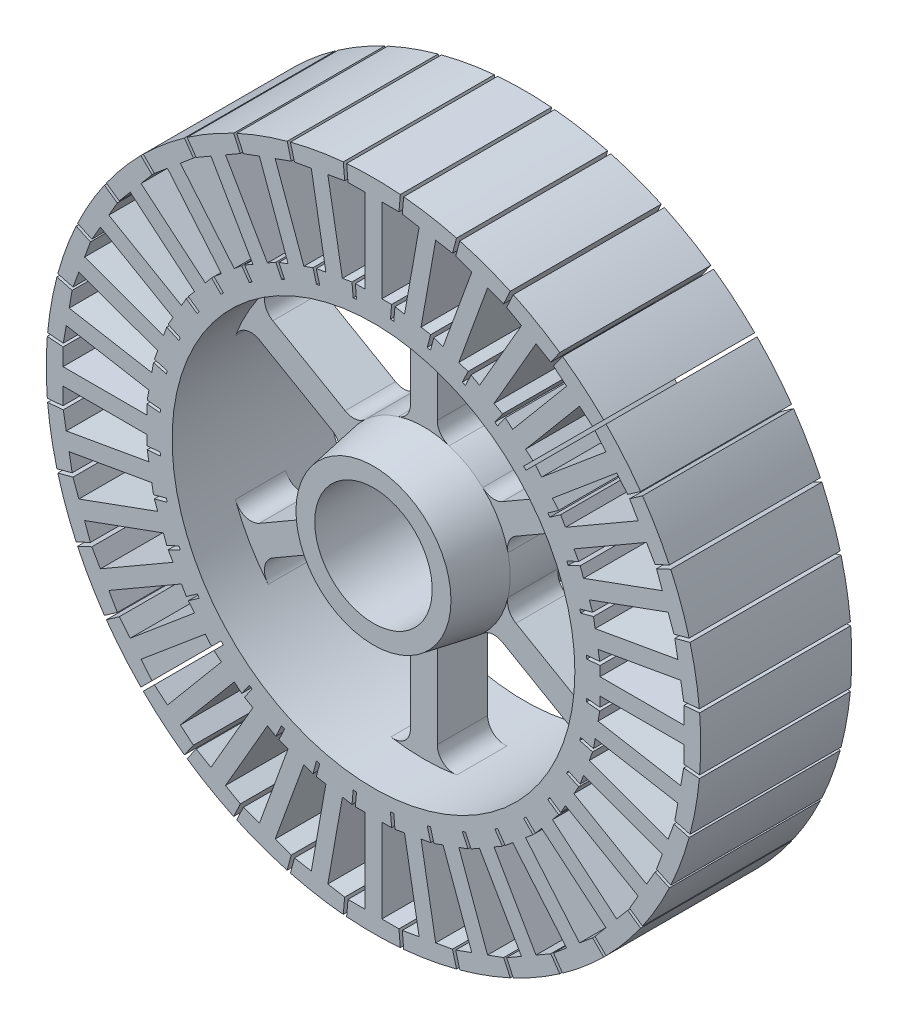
SolidWorks part; units mm, degrees
ref_plane "Спереди" through (0, 0, 0) normal (0, 0, 1) x (1, 0, 0)
ref_plane "Сверху" through (0, 0, 0) normal (0, 1, 0) x (1, 0, 0)
ref_plane "Справа" through (0, 0, 0) normal (1, 0, 0) x (0, 0, -1)
sketch "Эскиз1" plane through (0, 0, 0) normal (0, 0, 1) x (1, 0, 0)
  circle A0 centre (0, 0) radius 17.5
  circle A1 centre (0, 0) radius 97.5
  dimension "D1" = 35
  dimension "D2" = 195
extrude "Бобышка-Вытянуть1" add sketch "Эскиз1" along normal blind 45
sketch "Эскиз2" plane through (0, 0, 45) normal (0, 0, 1) x (1, 0, 0)
  line L0 (0, 0) -> (0, 97.5) construction
  line L1 (0, 0) -> (8.4977, 97.129) construction
  line L2 (0, 0) -> (-8.4977, 97.129) construction
  line L3 (-8.0518, 97.769) -> (-7.5908, 92.5)
  line L4 (-2.5, 92.5) -> (2.5, 92.5) construction
  line L5 (-2.5, 92.5) -> (-2.5, 67.5) construction
  line L6 (-2.5, 67.5) -> (2.5, 67.5) construction
  line L7 (2.5, 92.5) -> (2.5, 67.5) construction
  line L8 (0, 67.5) -> (0, 92.5) construction
  line L9 (-2.5, 80) -> (2.5, 80) construction
  line L10 (-7.5908, 92.5) -> (-2.5, 92.5)
  line L11 (-9.048, 97.6818) -> (-8.587, 92.4128)
  line L12 (-2.5, 67.5) -> (-5.4036, 67.5)
  line L13 (-5.4036, 67.5) -> (-5.0578, 63.5478)
  line L14 (-5.0578, 63.5478) -> (-6.054, 63.4607)
  line L15 (-2.5, 92.5) -> (-2.5, 67.5)
  line L16 (-8.587, 92.4128) -> (-13.6004, 91.5288)
  line L17 (-13.6004, 91.5288) -> (-9.2592, 66.9086)
  line L18 (-9.2592, 66.9086) -> (-6.3998, 67.4128)
  line L19 (-6.3998, 67.4128) -> (-6.054, 63.4607)
  line L20 (-8.0518, 97.769) -> (-9.048, 97.6818)
  line L21 (9.048, 97.6818) -> (8.0518, 97.769)
  line L22 (8.0518, 97.769) -> (7.5908, 92.5)
  line L23 (7.5908, 92.5) -> (2.5, 92.5)
  line L24 (2.5, 92.5) -> (2.5, 67.5)
  line L25 (2.5, 67.5) -> (5.4036, 67.5)
  line L26 (5.4036, 67.5) -> (5.0578, 63.5478)
  line L27 (6.054, 63.4607) -> (5.0578, 63.5478)
  line L28 (6.3998, 67.4128) -> (6.054, 63.4607)
  line L29 (9.2592, 66.9086) -> (6.3998, 67.4128)
  line L30 (13.6004, 91.5288) -> (9.2592, 66.9086)
  line L31 (8.587, 92.4128) -> (13.6004, 91.5288)
  line L32 (9.048, 97.6818) -> (8.587, 92.4128)
  line L33 (25.8728, 94.6267) -> (24.9068, 94.8855)
  line L34 (24.9068, 94.8855) -> (23.5379, 89.7766)
  line L35 (23.5379, 89.7766) -> (18.5245, 90.6606)
  line L36 (18.5245, 90.6606) -> (14.1833, 66.0404)
  line L37 (14.1833, 66.0404) -> (17.0427, 65.5362)
  line L38 (17.0427, 65.5362) -> (16.0159, 61.7041)
  line L39 (16.9819, 61.4453) -> (16.0159, 61.7041)
  line L40 (18.0087, 65.2774) -> (16.9819, 61.4453)
  line L41 (20.7371, 64.2843) -> (18.0087, 65.2774)
  line L42 (29.2876, 87.7766) -> (20.7371, 64.2843)
  line L43 (24.5039, 89.5178) -> (29.2876, 87.7766)
  line L44 (25.8728, 94.6267) -> (24.5039, 89.5178)
  line L45 (41.9115, 88.6963) -> (41.0051, 89.1189)
  line L46 (41.0051, 89.1189) -> (38.7699, 84.3254)
  line L47 (38.7699, 84.3254) -> (33.9861, 86.0665)
  line L48 (33.9861, 86.0665) -> (25.4356, 62.5742)
  line L49 (25.4356, 62.5742) -> (28.1641, 61.5811)
  line L50 (28.1641, 61.5811) -> (26.4874, 57.9856)
  line L51 (27.3937, 57.563) -> (26.4874, 57.9856)
  line L52 (29.0704, 61.1585) -> (27.3937, 57.563)
  line L53 (31.5849, 59.7067) -> (29.0704, 61.1585)
  line L54 (44.0849, 81.3573) -> (31.5849, 59.7067)
  line L55 (39.6762, 83.9027) -> (44.0849, 81.3573)
  line L56 (41.9115, 88.6963) -> (39.6762, 83.9027)
  line L57 (56.6767, 80.071) -> (55.8575, 80.6445)
  line L58 (55.8575, 80.6445) -> (52.8238, 76.312)
  line L59 (52.8238, 76.312) -> (48.4151, 78.8573)
  line L60 (48.4151, 78.8573) -> (35.9151, 57.2067)
  line L61 (35.9151, 57.2067) -> (38.4296, 55.7549)
  line L62 (38.4296, 55.7549) -> (36.1541, 52.5051)
  line L63 (36.9733, 51.9316) -> (36.1541, 52.5051)
  line L64 (39.2488, 55.1814) -> (36.9733, 51.9316)
  line L65 (41.4731, 53.315) -> (39.2488, 55.1814)
  line L66 (57.5427, 72.4661) -> (41.4731, 53.315)
  line L67 (53.643, 75.7384) -> (57.5427, 72.4661)
  line L68 (56.6767, 80.071) -> (53.643, 75.7384)
  line L69 (69.7198, 69.0127) -> (69.0127, 69.7198)
  line L70 (69.0127, 69.7198) -> (65.2727, 65.9798)
  line L71 (65.2727, 65.9798) -> (61.373, 69.2521)
  line L72 (61.373, 69.2521) -> (45.3033, 50.101)
  line L73 (45.3033, 50.101) -> (47.5275, 48.2346)
  line L74 (47.5275, 48.2346) -> (44.7223, 45.4294)
  line L75 (45.4294, 44.7223) -> (44.7223, 45.4294)
  line L76 (48.2346, 47.5275) -> (45.4294, 44.7223)
  line L77 (50.101, 45.3033) -> (48.2346, 47.5275)
  line L78 (69.2521, 61.373) -> (50.101, 45.3033)
  line L79 (65.9798, 65.2727) -> (69.2521, 61.373)
  line L80 (69.7198, 69.0127) -> (65.9798, 65.2727)
  line L81 (80.6445, 55.8575) -> (80.071, 56.6767)
  line L82 (80.071, 56.6767) -> (75.7384, 53.643)
  line L83 (75.7384, 53.643) -> (72.4661, 57.5427)
  line L84 (72.4661, 57.5427) -> (53.315, 41.4731)
  line L85 (53.315, 41.4731) -> (55.1814, 39.2488)
  line L86 (55.1814, 39.2488) -> (51.9316, 36.9733)
  line L87 (52.5051, 36.1541) -> (51.9316, 36.9733)
  line L88 (55.7549, 38.4296) -> (52.5051, 36.1541)
  line L89 (57.2067, 35.9151) -> (55.7549, 38.4296)
  line L90 (78.8573, 48.4151) -> (57.2067, 35.9151)
  line L91 (76.312, 52.8238) -> (78.8573, 48.4151)
  line L92 (80.6445, 55.8575) -> (76.312, 52.8238)
  line L93 (89.1189, 41.0051) -> (88.6963, 41.9115)
  line L94 (88.6963, 41.9115) -> (83.9027, 39.6762)
  line L95 (83.9027, 39.6762) -> (81.3573, 44.0849)
  line L96 (81.3573, 44.0849) -> (59.7067, 31.5849)
  line L97 (59.7067, 31.5849) -> (61.1585, 29.0704)
  line L98 (61.1585, 29.0704) -> (57.563, 27.3937)
  line L99 (57.9856, 26.4874) -> (57.563, 27.3937)
  line L100 (61.5811, 28.1641) -> (57.9856, 26.4874)
  line L101 (62.5742, 25.4356) -> (61.5811, 28.1641)
  line L102 (86.0665, 33.9861) -> (62.5742, 25.4356)
  line L103 (84.3254, 38.7699) -> (86.0665, 33.9861)
  line L104 (89.1189, 41.0051) -> (84.3254, 38.7699)
  line L105 (94.8855, 24.9068) -> (94.6267, 25.8728)
  line L106 (94.6267, 25.8728) -> (89.5178, 24.5039)
  line L107 (89.5178, 24.5039) -> (87.7766, 29.2876)
  line L108 (87.7766, 29.2876) -> (64.2843, 20.7371)
  line L109 (64.2843, 20.7371) -> (65.2774, 18.0087)
  line L110 (65.2774, 18.0087) -> (61.4453, 16.9819)
  line L111 (61.7041, 16.0159) -> (61.4453, 16.9819)
  line L112 (65.5362, 17.0427) -> (61.7041, 16.0159)
  line L113 (66.0404, 14.1833) -> (65.5362, 17.0427)
  line L114 (90.6606, 18.5245) -> (66.0404, 14.1833)
  line L115 (89.7766, 23.5379) -> (90.6606, 18.5245)
  line L116 (94.8855, 24.9068) -> (89.7766, 23.5379)
  line L117 (97.769, 8.0518) -> (97.6818, 9.048)
  line L118 (97.6818, 9.048) -> (92.4128, 8.587)
  line L119 (92.4128, 8.587) -> (91.5288, 13.6004)
  line L120 (91.5288, 13.6004) -> (66.9086, 9.2592)
  line L121 (66.9086, 9.2592) -> (67.4128, 6.3998)
  line L122 (67.4128, 6.3998) -> (63.4607, 6.054)
  line L123 (63.5478, 5.0578) -> (63.4607, 6.054)
  line L124 (67.5, 5.4036) -> (63.5478, 5.0578)
  line L125 (67.5, 2.5) -> (67.5, 5.4036)
  line L126 (92.5, 2.5) -> (67.5, 2.5)
  line L127 (92.5, 7.5908) -> (92.5, 2.5)
  line L128 (97.769, 8.0518) -> (92.5, 7.5908)
  line L129 (97.6818, -9.048) -> (97.769, -8.0518)
  line L130 (97.769, -8.0518) -> (92.5, -7.5908)
  line L131 (92.5, -7.5908) -> (92.5, -2.5)
  line L132 (92.5, -2.5) -> (67.5, -2.5)
  line L133 (67.5, -2.5) -> (67.5, -5.4036)
  line L134 (67.5, -5.4036) -> (63.5478, -5.0578)
  line L135 (63.4607, -6.054) -> (63.5478, -5.0578)
  line L136 (67.4128, -6.3998) -> (63.4607, -6.054)
  line L137 (66.9086, -9.2592) -> (67.4128, -6.3998)
  line L138 (91.5288, -13.6004) -> (66.9086, -9.2592)
  line L139 (92.4128, -8.587) -> (91.5288, -13.6004)
  line L140 (97.6818, -9.048) -> (92.4128, -8.587)
  line L141 (94.6267, -25.8728) -> (94.8855, -24.9068)
  line L142 (94.8855, -24.9068) -> (89.7766, -23.5379)
  line L143 (89.7766, -23.5379) -> (90.6606, -18.5245)
  line L144 (90.6606, -18.5245) -> (66.0404, -14.1833)
  line L145 (66.0404, -14.1833) -> (65.5362, -17.0427)
  line L146 (65.5362, -17.0427) -> (61.7041, -16.0159)
  line L147 (61.4453, -16.9819) -> (61.7041, -16.0159)
  line L148 (65.2774, -18.0087) -> (61.4453, -16.9819)
  line L149 (64.2843, -20.7371) -> (65.2774, -18.0087)
  line L150 (87.7766, -29.2876) -> (64.2843, -20.7371)
  line L151 (89.5178, -24.5039) -> (87.7766, -29.2876)
  line L152 (94.6267, -25.8728) -> (89.5178, -24.5039)
  line L153 (88.6963, -41.9115) -> (89.1189, -41.0051)
  line L154 (89.1189, -41.0051) -> (84.3254, -38.7699)
  line L155 (84.3254, -38.7699) -> (86.0665, -33.9861)
  line L156 (86.0665, -33.9861) -> (62.5742, -25.4356)
  line L157 (62.5742, -25.4356) -> (61.5811, -28.1641)
  line L158 (61.5811, -28.1641) -> (57.9856, -26.4874)
  line L159 (57.563, -27.3937) -> (57.9856, -26.4874)
  line L160 (61.1585, -29.0704) -> (57.563, -27.3937)
  line L161 (59.7067, -31.5849) -> (61.1585, -29.0704)
  line L162 (81.3573, -44.0849) -> (59.7067, -31.5849)
  line L163 (83.9027, -39.6762) -> (81.3573, -44.0849)
  line L164 (88.6963, -41.9115) -> (83.9027, -39.6762)
  line L165 (80.071, -56.6767) -> (80.6445, -55.8575)
  line L166 (80.6445, -55.8575) -> (76.312, -52.8238)
  line L167 (76.312, -52.8238) -> (78.8573, -48.4151)
  line L168 (78.8573, -48.4151) -> (57.2067, -35.9151)
  line L169 (57.2067, -35.9151) -> (55.7549, -38.4296)
  line L170 (55.7549, -38.4296) -> (52.5051, -36.1541)
  line L171 (51.9316, -36.9733) -> (52.5051, -36.1541)
  line L172 (55.1814, -39.2488) -> (51.9316, -36.9733)
  line L173 (53.315, -41.4731) -> (55.1814, -39.2488)
  line L174 (72.4661, -57.5427) -> (53.315, -41.4731)
  line L175 (75.7384, -53.643) -> (72.4661, -57.5427)
  line L176 (80.071, -56.6767) -> (75.7384, -53.643)
  line L177 (69.0127, -69.7198) -> (69.7198, -69.0127)
  line L178 (69.7198, -69.0127) -> (65.9798, -65.2727)
  line L179 (65.9798, -65.2727) -> (69.2521, -61.373)
  line L180 (69.2521, -61.373) -> (50.101, -45.3033)
  line L181 (50.101, -45.3033) -> (48.2346, -47.5275)
  line L182 (48.2346, -47.5275) -> (45.4294, -44.7223)
  line L183 (44.7223, -45.4294) -> (45.4294, -44.7223)
  line L184 (47.5275, -48.2346) -> (44.7223, -45.4294)
  line L185 (45.3033, -50.101) -> (47.5275, -48.2346)
  line L186 (61.373, -69.2521) -> (45.3033, -50.101)
  line L187 (65.2727, -65.9798) -> (61.373, -69.2521)
  line L188 (69.0127, -69.7198) -> (65.2727, -65.9798)
  line L189 (55.8575, -80.6445) -> (56.6767, -80.071)
  line L190 (56.6767, -80.071) -> (53.643, -75.7384)
  line L191 (53.643, -75.7384) -> (57.5427, -72.4661)
  line L192 (57.5427, -72.4661) -> (41.4731, -53.315)
  line L193 (41.4731, -53.315) -> (39.2488, -55.1814)
  line L194 (39.2488, -55.1814) -> (36.9733, -51.9316)
  line L195 (36.1541, -52.5051) -> (36.9733, -51.9316)
  line L196 (38.4296, -55.7549) -> (36.1541, -52.5051)
  line L197 (35.9151, -57.2067) -> (38.4296, -55.7549)
  line L198 (48.4151, -78.8573) -> (35.9151, -57.2067)
  line L199 (52.8238, -76.312) -> (48.4151, -78.8573)
  line L200 (55.8575, -80.6445) -> (52.8238, -76.312)
  line L201 (41.0051, -89.1189) -> (41.9115, -88.6963)
  line L202 (41.9115, -88.6963) -> (39.6762, -83.9027)
  line L203 (39.6762, -83.9027) -> (44.0849, -81.3573)
  line L204 (44.0849, -81.3573) -> (31.5849, -59.7067)
  line L205 (31.5849, -59.7067) -> (29.0704, -61.1585)
  line L206 (29.0704, -61.1585) -> (27.3937, -57.563)
  line L207 (26.4874, -57.9856) -> (27.3937, -57.563)
  line L208 (28.1641, -61.5811) -> (26.4874, -57.9856)
  line L209 (25.4356, -62.5742) -> (28.1641, -61.5811)
  line L210 (33.9861, -86.0665) -> (25.4356, -62.5742)
  line L211 (38.7699, -84.3254) -> (33.9861, -86.0665)
  line L212 (41.0051, -89.1189) -> (38.7699, -84.3254)
  line L213 (24.9068, -94.8855) -> (25.8728, -94.6267)
  line L214 (25.8728, -94.6267) -> (24.5039, -89.5178)
  line L215 (24.5039, -89.5178) -> (29.2876, -87.7766)
  line L216 (29.2876, -87.7766) -> (20.7371, -64.2843)
  line L217 (20.7371, -64.2843) -> (18.0087, -65.2774)
  line L218 (18.0087, -65.2774) -> (16.9819, -61.4453)
  line L219 (16.0159, -61.7041) -> (16.9819, -61.4453)
  line L220 (17.0427, -65.5362) -> (16.0159, -61.7041)
  line L221 (14.1833, -66.0404) -> (17.0427, -65.5362)
  line L222 (18.5245, -90.6606) -> (14.1833, -66.0404)
  line L223 (23.5379, -89.7766) -> (18.5245, -90.6606)
  line L224 (24.9068, -94.8855) -> (23.5379, -89.7766)
  line L225 (8.0518, -97.769) -> (9.048, -97.6818)
  line L226 (9.048, -97.6818) -> (8.587, -92.4128)
  line L227 (8.587, -92.4128) -> (13.6004, -91.5288)
  line L228 (13.6004, -91.5288) -> (9.2592, -66.9086)
  line L229 (9.2592, -66.9086) -> (6.3998, -67.4128)
  line L230 (6.3998, -67.4128) -> (6.054, -63.4607)
  line L231 (5.0578, -63.5478) -> (6.054, -63.4607)
  line L232 (5.4036, -67.5) -> (5.0578, -63.5478)
  line L233 (2.5, -67.5) -> (5.4036, -67.5)
  line L234 (2.5, -92.5) -> (2.5, -67.5)
  line L235 (7.5908, -92.5) -> (2.5, -92.5)
  line L236 (8.0518, -97.769) -> (7.5908, -92.5)
  line L237 (-9.048, -97.6818) -> (-8.0518, -97.769)
  line L238 (-8.0518, -97.769) -> (-7.5908, -92.5)
  line L239 (-7.5908, -92.5) -> (-2.5, -92.5)
  line L240 (-2.5, -92.5) -> (-2.5, -67.5)
  line L241 (-2.5, -67.5) -> (-5.4036, -67.5)
  line L242 (-5.4036, -67.5) -> (-5.0578, -63.5478)
  line L243 (-6.054, -63.4607) -> (-5.0578, -63.5478)
  line L244 (-6.3998, -67.4128) -> (-6.054, -63.4607)
  line L245 (-9.2592, -66.9086) -> (-6.3998, -67.4128)
  line L246 (-13.6004, -91.5288) -> (-9.2592, -66.9086)
  line L247 (-8.587, -92.4128) -> (-13.6004, -91.5288)
  line L248 (-9.048, -97.6818) -> (-8.587, -92.4128)
  line L249 (-25.8728, -94.6267) -> (-24.9068, -94.8855)
  line L250 (-24.9068, -94.8855) -> (-23.5379, -89.7766)
  line L251 (-23.5379, -89.7766) -> (-18.5245, -90.6606)
  line L252 (-18.5245, -90.6606) -> (-14.1833, -66.0404)
  line L253 (-14.1833, -66.0404) -> (-17.0427, -65.5362)
  line L254 (-17.0427, -65.5362) -> (-16.0159, -61.7041)
  line L255 (-16.9819, -61.4453) -> (-16.0159, -61.7041)
  line L256 (-18.0087, -65.2774) -> (-16.9819, -61.4453)
  line L257 (-20.7371, -64.2843) -> (-18.0087, -65.2774)
  line L258 (-29.2876, -87.7766) -> (-20.7371, -64.2843)
  line L259 (-24.5039, -89.5178) -> (-29.2876, -87.7766)
  line L260 (-25.8728, -94.6267) -> (-24.5039, -89.5178)
  line L261 (-41.9115, -88.6963) -> (-41.0051, -89.1189)
  line L262 (-41.0051, -89.1189) -> (-38.7699, -84.3254)
  line L263 (-38.7699, -84.3254) -> (-33.9861, -86.0665)
  line L264 (-33.9861, -86.0665) -> (-25.4356, -62.5742)
  line L265 (-25.4356, -62.5742) -> (-28.1641, -61.5811)
  line L266 (-28.1641, -61.5811) -> (-26.4874, -57.9856)
  line L267 (-27.3937, -57.563) -> (-26.4874, -57.9856)
  line L268 (-29.0704, -61.1585) -> (-27.3937, -57.563)
  line L269 (-31.5849, -59.7067) -> (-29.0704, -61.1585)
  line L270 (-44.0849, -81.3573) -> (-31.5849, -59.7067)
  line L271 (-39.6762, -83.9027) -> (-44.0849, -81.3573)
  line L272 (-41.9115, -88.6963) -> (-39.6762, -83.9027)
  line L273 (-56.6767, -80.071) -> (-55.8575, -80.6445)
  line L274 (-55.8575, -80.6445) -> (-52.8238, -76.312)
  line L275 (-52.8238, -76.312) -> (-48.4151, -78.8573)
  line L276 (-48.4151, -78.8573) -> (-35.9151, -57.2067)
  line L277 (-35.9151, -57.2067) -> (-38.4296, -55.7549)
  line L278 (-38.4296, -55.7549) -> (-36.1541, -52.5051)
  line L279 (-36.9733, -51.9316) -> (-36.1541, -52.5051)
  line L280 (-39.2488, -55.1814) -> (-36.9733, -51.9316)
  line L281 (-41.4731, -53.315) -> (-39.2488, -55.1814)
  line L282 (-57.5427, -72.4661) -> (-41.4731, -53.315)
  line L283 (-53.643, -75.7384) -> (-57.5427, -72.4661)
  line L284 (-56.6767, -80.071) -> (-53.643, -75.7384)
  line L285 (-69.7198, -69.0127) -> (-69.0127, -69.7198)
  line L286 (-69.0127, -69.7198) -> (-65.2727, -65.9798)
  line L287 (-65.2727, -65.9798) -> (-61.373, -69.2521)
  line L288 (-61.373, -69.2521) -> (-45.3033, -50.101)
  line L289 (-45.3033, -50.101) -> (-47.5275, -48.2346)
  line L290 (-47.5275, -48.2346) -> (-44.7223, -45.4294)
  line L291 (-45.4294, -44.7223) -> (-44.7223, -45.4294)
  line L292 (-48.2346, -47.5275) -> (-45.4294, -44.7223)
  line L293 (-50.101, -45.3033) -> (-48.2346, -47.5275)
  line L294 (-69.2521, -61.373) -> (-50.101, -45.3033)
  line L295 (-65.9798, -65.2727) -> (-69.2521, -61.373)
  line L296 (-69.7198, -69.0127) -> (-65.9798, -65.2727)
  line L297 (-80.6445, -55.8575) -> (-80.071, -56.6767)
  line L298 (-80.071, -56.6767) -> (-75.7384, -53.643)
  line L299 (-75.7384, -53.643) -> (-72.4661, -57.5427)
  line L300 (-72.4661, -57.5427) -> (-53.315, -41.4731)
  line L301 (-53.315, -41.4731) -> (-55.1814, -39.2488)
  line L302 (-55.1814, -39.2488) -> (-51.9316, -36.9733)
  line L303 (-52.5051, -36.1541) -> (-51.9316, -36.9733)
  line L304 (-55.7549, -38.4296) -> (-52.5051, -36.1541)
  line L305 (-57.2067, -35.9151) -> (-55.7549, -38.4296)
  line L306 (-78.8573, -48.4151) -> (-57.2067, -35.9151)
  line L307 (-76.312, -52.8238) -> (-78.8573, -48.4151)
  line L308 (-80.6445, -55.8575) -> (-76.312, -52.8238)
  line L309 (-89.1189, -41.0051) -> (-88.6963, -41.9115)
  line L310 (-88.6963, -41.9115) -> (-83.9027, -39.6762)
  line L311 (-83.9027, -39.6762) -> (-81.3573, -44.0849)
  line L312 (-81.3573, -44.0849) -> (-59.7067, -31.5849)
  line L313 (-59.7067, -31.5849) -> (-61.1585, -29.0704)
  line L314 (-61.1585, -29.0704) -> (-57.563, -27.3937)
  line L315 (-57.9856, -26.4874) -> (-57.563, -27.3937)
  line L316 (-61.5811, -28.1641) -> (-57.9856, -26.4874)
  line L317 (-62.5742, -25.4356) -> (-61.5811, -28.1641)
  line L318 (-86.0665, -33.9861) -> (-62.5742, -25.4356)
  line L319 (-84.3254, -38.7699) -> (-86.0665, -33.9861)
  line L320 (-89.1189, -41.0051) -> (-84.3254, -38.7699)
  line L321 (-94.8855, -24.9068) -> (-94.6267, -25.8728)
  line L322 (-94.6267, -25.8728) -> (-89.5178, -24.5039)
  line L323 (-89.5178, -24.5039) -> (-87.7766, -29.2876)
  line L324 (-87.7766, -29.2876) -> (-64.2843, -20.7371)
  line L325 (-64.2843, -20.7371) -> (-65.2774, -18.0087)
  line L326 (-65.2774, -18.0087) -> (-61.4453, -16.9819)
  line L327 (-61.7041, -16.0159) -> (-61.4453, -16.9819)
  line L328 (-65.5362, -17.0427) -> (-61.7041, -16.0159)
  line L329 (-66.0404, -14.1833) -> (-65.5362, -17.0427)
  line L330 (-90.6606, -18.5245) -> (-66.0404, -14.1833)
  line L331 (-89.7766, -23.5379) -> (-90.6606, -18.5245)
  line L332 (-94.8855, -24.9068) -> (-89.7766, -23.5379)
  line L333 (-97.769, -8.0518) -> (-97.6818, -9.048)
  line L334 (-97.6818, -9.048) -> (-92.4128, -8.587)
  line L335 (-92.4128, -8.587) -> (-91.5288, -13.6004)
  line L336 (-91.5288, -13.6004) -> (-66.9086, -9.2592)
  line L337 (-66.9086, -9.2592) -> (-67.4128, -6.3998)
  line L338 (-67.4128, -6.3998) -> (-63.4607, -6.054)
  line L339 (-63.5478, -5.0578) -> (-63.4607, -6.054)
  line L340 (-67.5, -5.4036) -> (-63.5478, -5.0578)
  line L341 (-67.5, -2.5) -> (-67.5, -5.4036)
  line L342 (-92.5, -2.5) -> (-67.5, -2.5)
  line L343 (-92.5, -7.5908) -> (-92.5, -2.5)
  line L344 (-97.769, -8.0518) -> (-92.5, -7.5908)
  line L345 (-97.6818, 9.048) -> (-97.769, 8.0518)
  line L346 (-97.769, 8.0518) -> (-92.5, 7.5908)
  line L347 (-92.5, 7.5908) -> (-92.5, 2.5)
  line L348 (-92.5, 2.5) -> (-67.5, 2.5)
  line L349 (-67.5, 2.5) -> (-67.5, 5.4036)
  line L350 (-67.5, 5.4036) -> (-63.5478, 5.0578)
  line L351 (-63.4607, 6.054) -> (-63.5478, 5.0578)
  line L352 (-67.4128, 6.3998) -> (-63.4607, 6.054)
  line L353 (-66.9086, 9.2592) -> (-67.4128, 6.3998)
  line L354 (-91.5288, 13.6004) -> (-66.9086, 9.2592)
  line L355 (-92.4128, 8.587) -> (-91.5288, 13.6004)
  line L356 (-97.6818, 9.048) -> (-92.4128, 8.587)
  line L357 (-94.6267, 25.8728) -> (-94.8855, 24.9068)
  line L358 (-94.8855, 24.9068) -> (-89.7766, 23.5379)
  line L359 (-89.7766, 23.5379) -> (-90.6606, 18.5245)
  line L360 (-90.6606, 18.5245) -> (-66.0404, 14.1833)
  line L361 (-66.0404, 14.1833) -> (-65.5362, 17.0427)
  line L362 (-65.5362, 17.0427) -> (-61.7041, 16.0159)
  line L363 (-61.4453, 16.9819) -> (-61.7041, 16.0159)
  line L364 (-65.2774, 18.0087) -> (-61.4453, 16.9819)
  line L365 (-64.2843, 20.7371) -> (-65.2774, 18.0087)
  line L366 (-87.7766, 29.2876) -> (-64.2843, 20.7371)
  line L367 (-89.5178, 24.5039) -> (-87.7766, 29.2876)
  line L368 (-94.6267, 25.8728) -> (-89.5178, 24.5039)
  line L369 (-88.6963, 41.9115) -> (-89.1189, 41.0051)
  line L370 (-89.1189, 41.0051) -> (-84.3254, 38.7699)
  line L371 (-84.3254, 38.7699) -> (-86.0665, 33.9861)
  line L372 (-86.0665, 33.9861) -> (-62.5742, 25.4356)
  line L373 (-62.5742, 25.4356) -> (-61.5811, 28.1641)
  line L374 (-61.5811, 28.1641) -> (-57.9856, 26.4874)
  line L375 (-57.563, 27.3937) -> (-57.9856, 26.4874)
  line L376 (-61.1585, 29.0704) -> (-57.563, 27.3937)
  line L377 (-59.7067, 31.5849) -> (-61.1585, 29.0704)
  line L378 (-81.3573, 44.0849) -> (-59.7067, 31.5849)
  line L379 (-83.9027, 39.6762) -> (-81.3573, 44.0849)
  line L380 (-88.6963, 41.9115) -> (-83.9027, 39.6762)
  line L381 (-80.071, 56.6767) -> (-80.6445, 55.8575)
  line L382 (-80.6445, 55.8575) -> (-76.312, 52.8238)
  line L383 (-76.312, 52.8238) -> (-78.8573, 48.4151)
  line L384 (-78.8573, 48.4151) -> (-57.2067, 35.9151)
  line L385 (-57.2067, 35.9151) -> (-55.7549, 38.4296)
  line L386 (-55.7549, 38.4296) -> (-52.5051, 36.1541)
  line L387 (-51.9316, 36.9733) -> (-52.5051, 36.1541)
  line L388 (-55.1814, 39.2488) -> (-51.9316, 36.9733)
  line L389 (-53.315, 41.4731) -> (-55.1814, 39.2488)
  line L390 (-72.4661, 57.5427) -> (-53.315, 41.4731)
  line L391 (-75.7384, 53.643) -> (-72.4661, 57.5427)
  line L392 (-80.071, 56.6767) -> (-75.7384, 53.643)
  line L393 (-69.0127, 69.7198) -> (-69.7198, 69.0127)
  line L394 (-69.7198, 69.0127) -> (-65.9798, 65.2727)
  line L395 (-65.9798, 65.2727) -> (-69.2521, 61.373)
  line L396 (-69.2521, 61.373) -> (-50.101, 45.3033)
  line L397 (-50.101, 45.3033) -> (-48.2346, 47.5275)
  line L398 (-48.2346, 47.5275) -> (-45.4294, 44.7223)
  line L399 (-44.7223, 45.4294) -> (-45.4294, 44.7223)
  line L400 (-47.5275, 48.2346) -> (-44.7223, 45.4294)
  line L401 (-45.3033, 50.101) -> (-47.5275, 48.2346)
  line L402 (-61.373, 69.2521) -> (-45.3033, 50.101)
  line L403 (-65.2727, 65.9798) -> (-61.373, 69.2521)
  line L404 (-69.0127, 69.7198) -> (-65.2727, 65.9798)
  line L405 (-55.8575, 80.6445) -> (-56.6767, 80.071)
  line L406 (-56.6767, 80.071) -> (-53.643, 75.7384)
  line L407 (-53.643, 75.7384) -> (-57.5427, 72.4661)
  line L408 (-57.5427, 72.4661) -> (-41.4731, 53.315)
  line L409 (-41.4731, 53.315) -> (-39.2488, 55.1814)
  line L410 (-39.2488, 55.1814) -> (-36.9733, 51.9316)
  line L411 (-36.1541, 52.5051) -> (-36.9733, 51.9316)
  line L412 (-38.4296, 55.7549) -> (-36.1541, 52.5051)
  line L413 (-35.9151, 57.2067) -> (-38.4296, 55.7549)
  line L414 (-48.4151, 78.8573) -> (-35.9151, 57.2067)
  line L415 (-52.8238, 76.312) -> (-48.4151, 78.8573)
  line L416 (-55.8575, 80.6445) -> (-52.8238, 76.312)
  line L417 (-41.0051, 89.1189) -> (-41.9115, 88.6963)
  line L418 (-41.9115, 88.6963) -> (-39.6762, 83.9027)
  line L419 (-39.6762, 83.9027) -> (-44.0849, 81.3573)
  line L420 (-44.0849, 81.3573) -> (-31.5849, 59.7067)
  line L421 (-31.5849, 59.7067) -> (-29.0704, 61.1585)
  line L422 (-29.0704, 61.1585) -> (-27.3937, 57.563)
  line L423 (-26.4874, 57.9856) -> (-27.3937, 57.563)
  line L424 (-28.1641, 61.5811) -> (-26.4874, 57.9856)
  line L425 (-25.4356, 62.5742) -> (-28.1641, 61.5811)
  line L426 (-33.9861, 86.0665) -> (-25.4356, 62.5742)
  line L427 (-38.7699, 84.3254) -> (-33.9861, 86.0665)
  line L428 (-41.0051, 89.1189) -> (-38.7699, 84.3254)
  line L429 (-24.9068, 94.8855) -> (-25.8728, 94.6267)
  line L430 (-25.8728, 94.6267) -> (-24.5039, 89.5178)
  line L431 (-24.5039, 89.5178) -> (-29.2876, 87.7766)
  line L432 (-29.2876, 87.7766) -> (-20.7371, 64.2843)
  line L433 (-20.7371, 64.2843) -> (-18.0087, 65.2774)
  line L434 (-18.0087, 65.2774) -> (-16.9819, 61.4453)
  line L435 (-16.0159, 61.7041) -> (-16.9819, 61.4453)
  line L436 (-17.0427, 65.5362) -> (-16.0159, 61.7041)
  line L437 (-14.1833, 66.0404) -> (-17.0427, 65.5362)
  line L438 (-18.5245, 90.6606) -> (-14.1833, 66.0404)
  line L439 (-23.5379, 89.7766) -> (-18.5245, 90.6606)
  line L440 (-24.9068, 94.8855) -> (-23.5379, 89.7766)
  circle A0 centre (0, 0) radius 97.5 construction
  point P6 (0, 80)
  point P26 (-5.5559, 63.5043)
  point P451 (0, 0)
  dimension "D6" = 0.5
  dimension "D1" = 5
  dimension "D2" = 5
  dimension "D3" = 25
  dimension "D4" = 5
  dimension "D5" = 5
  dimension "D7" = 0.5
  dimension "D8" = 36
extrude "Вырез-Вытянуть1" cut sketch "Эскиз2" against normal through all contours L20 L11 L16 L17 L18 L19 L14 L13 L12 L15 L10 L3
sketch "Эскиз3" plane through (0, 0, 45) normal (0, 0, 1) x (1, 0, 0)
  circle A0 centre (0, 0) radius 60
  circle A1 centre (0, 0) radius 27.5
  dimension "D1" = 120
  dimension "D2" = 55
extrude "Вырез-Вытянуть2" cut sketch "Эскиз3" against normal blind 15
sketch "Эскиз4" plane through (0, 0, 0) normal (0, 0, -1) x (-1, 0, 0)
  circle A0 centre (0, 0) radius 60
  circle A1 centre (0, 0) radius 27.5
  dimension "D1" = 120
  dimension "D2" = 55
extrude "Вырез-Вытянуть3" cut sketch "Эскиз4" against normal blind 15
chamfer "Фаска1" distance 25 angle 10 2 edges at (-27.5, 0, 0) (27.5, 0, 45)
sketch "Эскиз6" plane through (0, 0, 30) normal (0, 0, 1) x (1, 0, 0)
  line L0 (0, 0) -> (0, 60) construction
  line L1 (0, 0) -> (51.9615, 30) construction
  line L2 (0, 25.7367) -> (0, 60) construction
  line L3 (22.2887, 12.8684) -> (51.9615, 30) construction
  line L4 (4, 29.3896) -> (4, 54.2586)
  line L5 (23.4521, 18.1589) -> (44.9894, 30.5934)
  line L6 (27.4521, -11.2307) -> (48.9894, -23.6652)
  line L7 (27.4521, 11.2307) -> (48.9894, 23.6652)
  line L8 (4, -29.3896) -> (4, -54.2586)
  line L9 (23.4521, -18.1589) -> (44.9894, -30.5934)
  line L10 (-23.4521, -18.1589) -> (-44.9894, -30.5934)
  line L11 (-4, -29.3896) -> (-4, -54.2586)
  line L12 (-27.4521, 11.2307) -> (-48.9894, 23.6652)
  line L13 (-27.4521, -11.2307) -> (-48.9894, -23.6652)
  line L14 (-4, 29.3896) -> (-4, 54.2586)
  line L15 (-23.4521, 18.1589) -> (-44.9894, 30.5934)
  circle A0 centre (0, 0) radius 60 construction
  arc A1 (0, 25.7367) -> (22.2887, 12.8684) centre (0, 0) cw construction
  circle A2 centre (0, 0) radius 25.7367 construction
  arc A3 (0, 60) -> (51.9615, 30) centre (0, 0) cw construction
  arc A4 (7.536, 24.6087) -> (17.5438, 18.8307) centre (0, 0) cw
  arc A5 (9.8182, 59.1912) -> (46.352, 38.0984) centre (0, 0) cw
  arc A6 (4, 29.3896) -> (7.536, 24.6087) centre (9, 29.3896) ccw
  arc A7 (23.4521, 18.1589) -> (17.5438, 18.8307) centre (20.9521, 22.489) cw
  arc A8 (44.9894, 30.5934) -> (46.352, 38.0984) centre (42.4894, 34.9235) ccw
  arc A9 (4, 54.2586) -> (9.8182, 59.1912) centre (9, 54.2586) cw
  arc A10 (56.1702, 21.0928) -> (56.1702, -21.0928) centre (0, 0) cw
  arc A11 (48.9894, 23.6652) -> (56.1702, 21.0928) centre (51.4894, 19.3351) cw
  arc A12 (48.9894, -23.6652) -> (56.1702, -21.0928) centre (51.4894, -19.3351) ccw
  arc A13 (27.4521, -11.2307) -> (25.0797, -5.778) centre (29.9521, -6.9006) cw
  arc A14 (25.0797, 5.778) -> (25.0797, -5.778) centre (0, 0) cw
  arc A15 (27.4521, 11.2307) -> (25.0797, 5.778) centre (29.9521, 6.9006) ccw
  arc A16 (46.352, -38.0984) -> (9.8182, -59.1912) centre (0, 0) cw
  arc A17 (44.9894, -30.5934) -> (46.352, -38.0984) centre (42.4894, -34.9235) cw
  arc A18 (4, -54.2586) -> (9.8182, -59.1912) centre (9, -54.2586) ccw
  arc A19 (4, -29.3896) -> (7.536, -24.6087) centre (9, -29.3896) cw
  arc A20 (17.5438, -18.8307) -> (7.536, -24.6087) centre (0, 0) cw
  arc A21 (23.4521, -18.1589) -> (17.5438, -18.8307) centre (20.9521, -22.489) ccw
  arc A22 (-9.8182, -59.1912) -> (-46.352, -38.0984) centre (0, 0) cw
  arc A23 (-4, -54.2586) -> (-9.8182, -59.1912) centre (-9, -54.2586) cw
  arc A24 (-44.9894, -30.5934) -> (-46.352, -38.0984) centre (-42.4894, -34.9235) ccw
  arc A25 (-23.4521, -18.1589) -> (-17.5438, -18.8307) centre (-20.9521, -22.489) cw
  arc A26 (-7.536, -24.6087) -> (-17.5438, -18.8307) centre (0, 0) cw
  arc A27 (-4, -29.3896) -> (-7.536, -24.6087) centre (-9, -29.3896) ccw
  arc A28 (-56.1702, -21.0928) -> (-56.1702, 21.0928) centre (0, 0) cw
  arc A29 (-48.9894, -23.6652) -> (-56.1702, -21.0928) centre (-51.4894, -19.3351) cw
  arc A30 (-48.9894, 23.6652) -> (-56.1702, 21.0928) centre (-51.4894, 19.3351) ccw
  arc A31 (-27.4521, 11.2307) -> (-25.0797, 5.778) centre (-29.9521, 6.9006) cw
  arc A32 (-25.0797, -5.778) -> (-25.0797, 5.778) centre (0, 0) cw
  arc A33 (-27.4521, -11.2307) -> (-25.0797, -5.778) centre (-29.9521, -6.9006) ccw
  arc A34 (-46.352, 38.0984) -> (-9.8182, 59.1912) centre (0, 0) cw
  arc A35 (-44.9894, 30.5934) -> (-46.352, 38.0984) centre (-42.4894, 34.9235) cw
  arc A36 (-4, 54.2586) -> (-9.8182, 59.1912) centre (-9, 54.2586) ccw
  arc A37 (-4, 29.3896) -> (-7.536, 24.6087) centre (-9, 29.3896) cw
  arc A38 (-17.5438, 18.8307) -> (-7.536, 24.6087) centre (0, 0) cw
  arc A39 (-23.4521, 18.1589) -> (-17.5438, 18.8307) centre (-20.9521, 22.489) ccw
  point P21 (4, 25.424)
  point P24 (20.0178, 16.1761)
  point P27 (49.8459, 33.3974)
  point P30 (4, 59.8665)
  point P93 (0, 0)
  dimension "D2" = 4
  dimension "D4" = 5
  dimension "D1" = 60
  dimension "D3" = 4
  dimension "D5" = 6
extrude "Вырез-Вытянуть4" cut sketch "Эскиз6" against normal through all contours A5 A8 L5 A7 A4 A6 L4 A9
